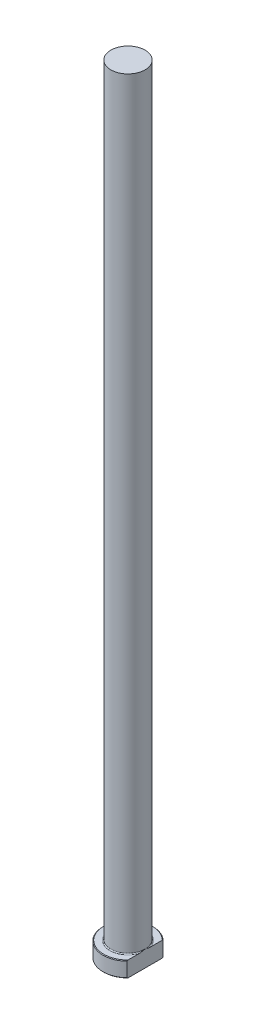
SolidWorks part; units mm, degrees
ref_plane "Front Plane" through (0, 0, 0) normal (0, 0, 1) x (1, 0, 0)
ref_plane "Top Plane" through (0, 0, 0) normal (0, 1, 0) x (1, 0, 0)
ref_plane "Right Plane" through (0, 0, 0) normal (1, 0, 0) x (0, 0, -1)
sketch "Sketch1" plane through (0, 0, 0) normal (0, 0, 1) x (1, 0, 0)
  line L0 (0, 259.9588) -> (0, -15.1925) construction
  line L1 (0, 0) -> (-8, 0)
  line L2 (-8, 0) -> (-8, 5)
  line L3 (-8, 5) -> (-5.5, 5)
  line L4 (-5.5, 5) -> (-5.5, 250)
  line L5 (-5.5, 250) -> (0, 250)
  line L6 (0, 250) -> (0, 0)
  dimension "L" = 250
  dimension "H" = 16
  dimension "T" = 5
  dimension "D" = 11
revolve "Revolve1" add sketch "Sketch1" angle 360 about L0
chamfer "Chamfer1" distance 0.2 angle 45 2 edges at (0, 5, 8) (0, 0, 8)
fillet "Fillet1" radius 0.3 1 edges at (0, 5, 5.5)
sketch "Sketch2" plane through (0, 0, 0) normal (0, 1, 0) x (1, 0, 0)
  line L0 (5.5, 5.8095) -> (5.5, -5.8095)
  circle A0 centre (0, 0) radius 8 construction
  arc A1 (5.5, -5.8095) -> (5.5, 5.8095) centre (0, 0) ccw
  circle A2 centre (0, 0) radius 5.5 construction
extrude "KEY" cut sketch "Sketch2" along normal through all
